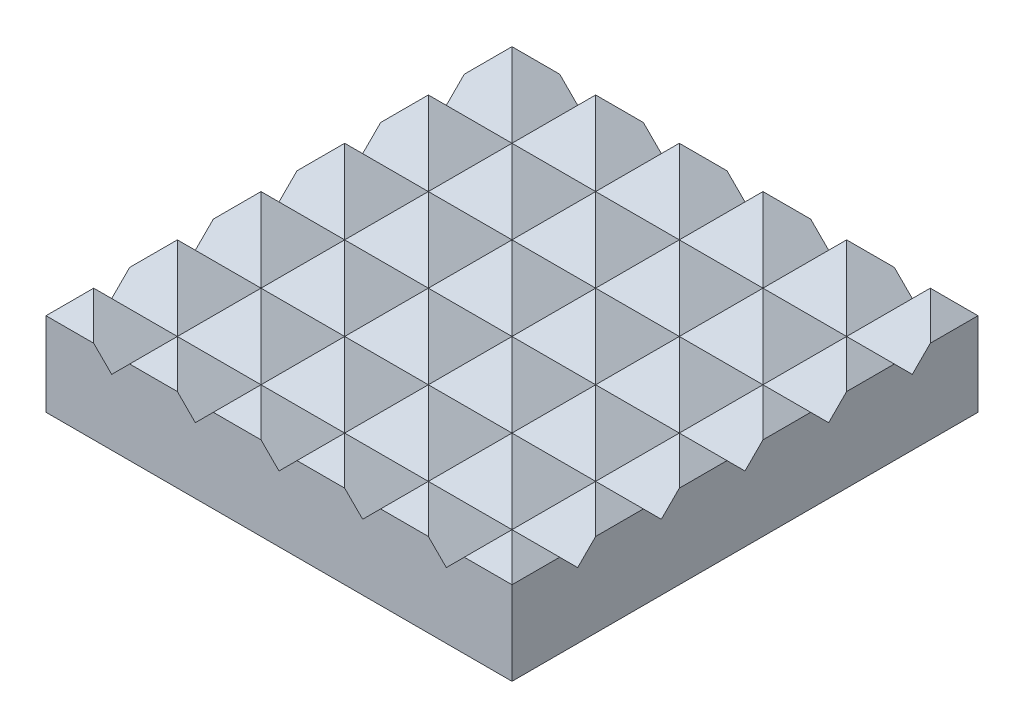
SolidWorks part; units mm, degrees
ref_plane "Front Plane" through (0, 0, 0) normal (0, 0, 1) x (1, 0, 0)
ref_plane "Top Plane" through (0, 0, 0) normal (0, 1, 0) x (1, 0, 0)
ref_plane "Right Plane" through (0, 0, 0) normal (1, 0, 0) x (0, 0, -1)
sketch "Sketch1" plane through (0, 0, 0) normal (0, 1, 0) x (1, 0, 0)
  line L0 (-6.35, -6.35) -> (-6.35, 6.35)
  line L1 (0, 0) -> (0, 50000) construction
  line L2 (0, 0) -> (50000, 0) construction
  line L3 (-6.35, 6.35) -> (6.35, 6.35)
  line L4 (6.35, -6.35) -> (6.35, 6.35)
  line L5 (-6.35, -6.35) -> (6.35, -6.35)
  point P10 (0, 6.35)
  point P11 (6.35, 0)
  point P12 (-6.35, 0)
  dimension "D1" = 12.7
  dimension "D2" = 12.7
extrude "Extrude1" add sketch "Sketch1" along normal mid plane 3.18
sketch "Sketch2" plane through (0, 0, 6.35) normal (0, 0, 1) x (1, 0, 0)
  line L0 (-6.84, 1.59) -> (-7.98, 1.59)
  line L1 (-7.98, 1.59) -> (-6.84, 0.45)
  line L2 (-6.35, -1.59) -> (6.35, -1.59) construction
  line L3 (-6.84, 0.45) -> (-5.7, 1.59)
  line L5 (-5.7, 1.59) -> (-6.84, 1.59)
  line L10 (-6.35, 1.59) -> (-6.35, -1.59) construction
  dimension "D1" = 2.28
  dimension "D2" = 1.63
  dimension "D3" = 3.18
extrude "Extrude3" cut sketch "Sketch2" against normal through all
pattern_linear "LPattern2" count 7 spacing 2.28 along (0.7071, -0.7071, 0) of "Extrude3"
sketch "Sketch3" plane through (6.35, 0, 0) normal (1, 0, 0) x (0, 0, -1)
  line L0 (-6.84, 1.59) -> (-5.7, 1.59)
  line L2 (-5.7, 1.59) -> (-6.84, 0.45)
  line L3 (-6.84, 0.45) -> (-7.98, 1.59)
  line L4 (-7.98, 1.59) -> (-6.84, 1.59)
  line L5 (-6.35, 0.94) -> (-6.35, -1.59) construction
  line L6 (7.94, 0.49) -> (-7.94, 0.49) construction
  line L8 (-6.35, -1.59) -> (6.35, -1.59) construction
  dimension "D1" = 2.28
  dimension "D2" = 1.63
  dimension "D3" = 3.18
extrude "Extrude4" cut sketch "Sketch3" against normal through all
pattern_linear "LPattern3" count 7 spacing 2.28 along (0, -0.7071, -0.7071) of "Extrude4"
chamfer "Chamfer1" distance 0.25 angle 45 4 edges at (-6.35, -1.59, 0) (0, -1.59, -6.35) (6.35, -1.59, 0) (0, -1.59, 6.35)
equation "\"D2@Sketch1\" = \"D1@Sketch1\""
equation "\"D1@Sketch3\" = \"D1@Sketch2\""
equation "\"D2@Sketch3\" = \"D2@Sketch2\""
equation "\"D3@Sketch3\" = \"D1@Extrude1\""
equation "\"D3@Sketch2\" = \"D1@Extrude1\""
